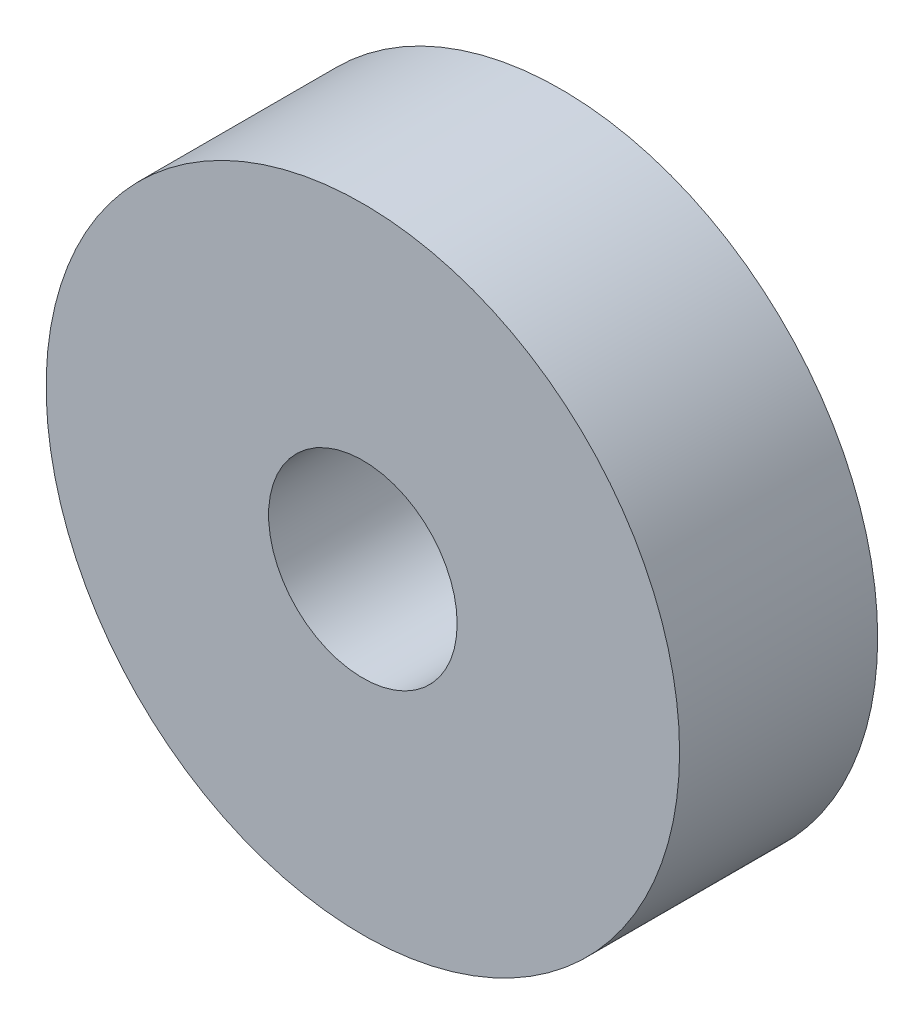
SolidWorks part; units mm, degrees
ref_plane "Front Plane" through (0, 0, 0) normal (0, 0, 1) x (1, 0, 0)
ref_plane "Top Plane" through (0, 0, 0) normal (0, 1, 0) x (1, 0, 0)
ref_plane "Right Plane" through (0, 0, 0) normal (1, 0, 0) x (0, 0, -1)
sketch "Sketch1" plane through (0, 0, 0) normal (0, 0, 1) x (1, 0, 0)
  circle A0 centre (0, 0) radius 5
  circle A1 centre (0, 0) radius 1.5875
  dimension "D1" = 3.175
  dimension "D2" = 10
extrude "Boss-Extrude1" add sketch "Sketch1" along normal blind 3.175
other "Move Face1" parameters "D1"=0.0762
